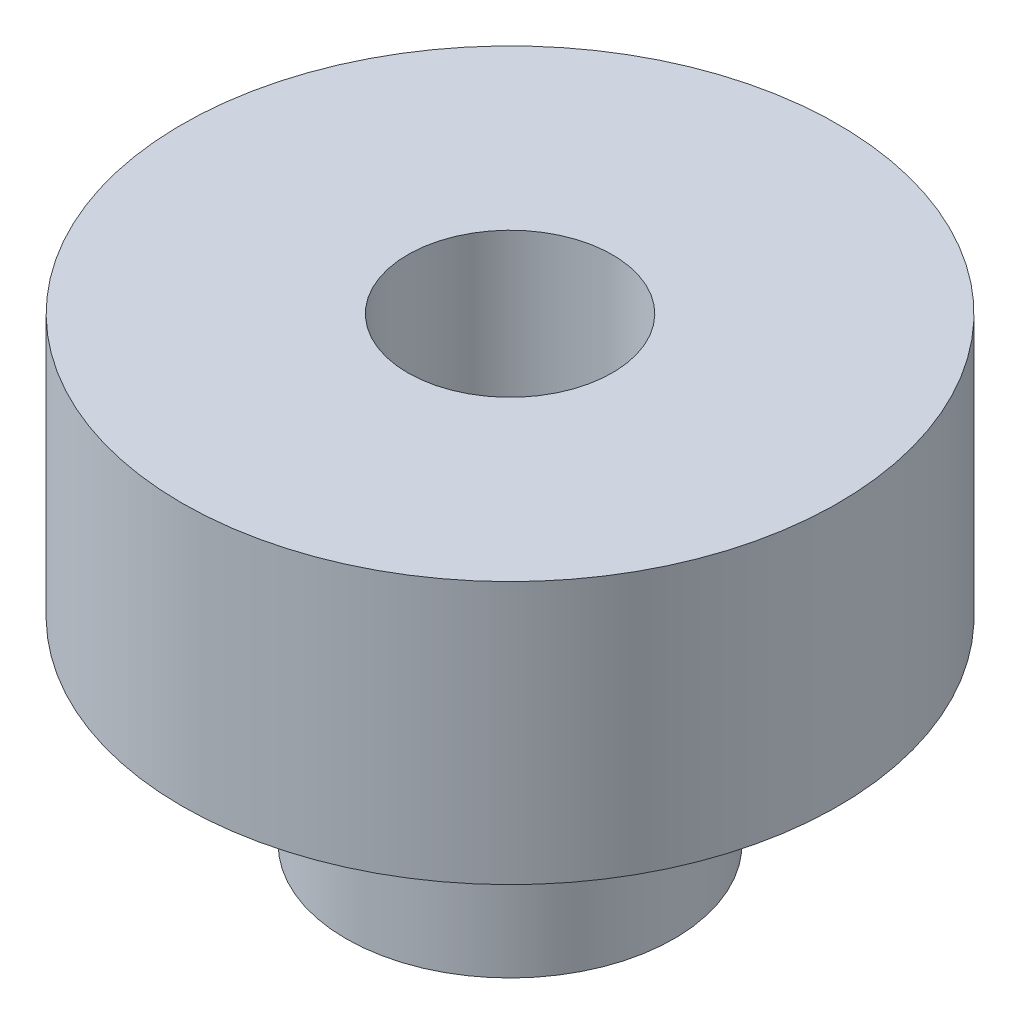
SolidWorks part; units mm, degrees
ref_plane "Plane1" through (0, 0, 0) normal (0, 0, 1) x (1, 0, 0)
ref_plane "Plane2" through (0, 0, 0) normal (0, 1, 0) x (1, 0, 0)
ref_plane "Plane3" through (0, 0, 0) normal (1, 0, 0) x (0, 0, -1)
sketch "Sketch1" plane through (0, 0, 0) normal (0, 0, 1) x (1, 0, 0)
  line L0 (0, 0) -> (6.35, 0)
  line L1 (6.35, 0) -> (6.35, -5.08)
  line L2 (6.35, -5.08) -> (3.175, -5.08)
  line L3 (3.175, -5.08) -> (3.175, -8.89)
  line L4 (3.175, -8.89) -> (0, -8.89)
  line L5 (0, -8.89) -> (0, 0)
  line L6 (0, 75.5991) -> (0, -93.6475) construction
  dimension "D1" = 5.08
  dimension "D2" = 8.89
  dimension "D3" = 6.35
  dimension "D4" = 3.175
revolve "Base-Revolve" add sketch "Sketch1" angle 360 about L6
sketch "Sketch2" plane through (0, 0, 0) normal (0, 1, 0) x (-1, 0, 0)
  circle A0 centre (0, 0) radius 1.9812
  dimension "D1" = 3.9624
extrude "Cut-Extrude1" cut sketch "Sketch2" against normal through all
